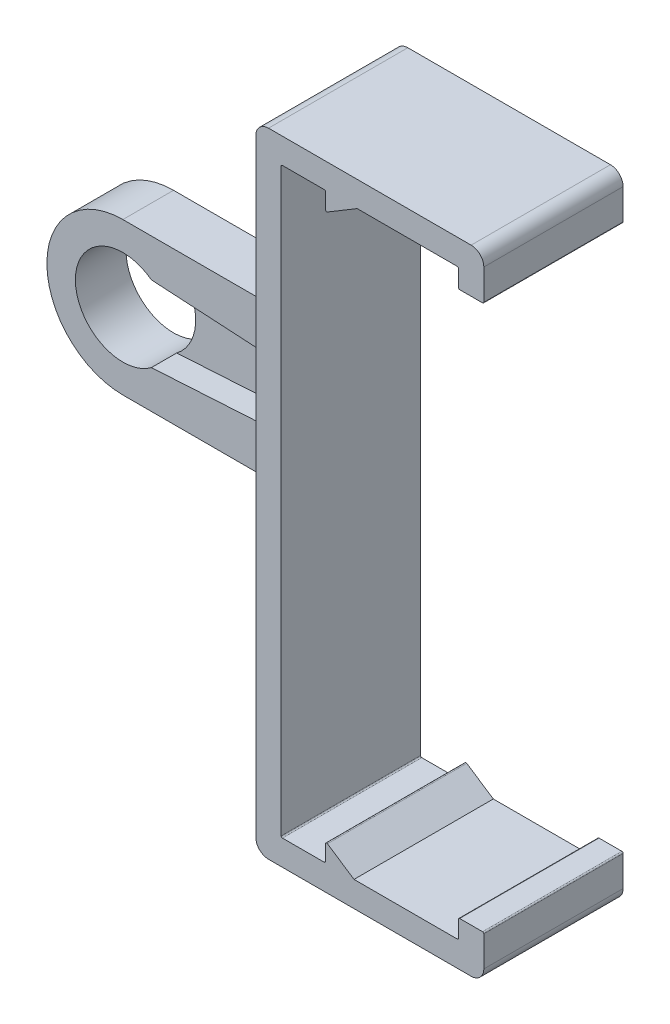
SolidWorks part; units mm, degrees
ref_plane "Front Plane" through (0, 0, 0) normal (0, 0, 1) x (1, 0, 0)
ref_plane "Top Plane" through (0, 0, 0) normal (0, 1, 0) x (1, 0, 0)
ref_plane "Right Plane" through (0, 0, 0) normal (1, 0, 0) x (0, 0, -1)
sketch "草图1" plane through (0, 0, 0) normal (0, 0, 1) x (1, 0, 0)
  line L9 (16.5828, -12.9023) -> (36.5828, -12.9023) construction
  line L10 (36.5828, -6.9023) -> (36.5828, -18.9023)
  line L11 (36.5828, -6.9023) -> (16.5828, -6.9023)
  line L12 (36.5828, -18.9023) -> (16.5828, -18.9023)
  circle A6 centre (16.5828, -12.9023) radius 3.75
  arc A7 (16.5828, -6.9023) -> (16.5828, -18.9023) centre (16.5828, -12.9023) ccw
  point P7 (36.5828, -12.9023)
  dimension "D1" = 7.5
  dimension "D2" = 12
  dimension "D3" = 20
  dimension "D4" = 12
extrude "凸台-拉伸1" add sketch "草图1" along normal blind 4
sketch "草图2" plane through (0, 0, 4) normal (0, 0, 1) x (1, 0, 0)
  line L0 (16.5828, -12.9023) -> (31.5828, -12.9023) construction
  line L1 (31.5828, -15.1523) -> (18.8328, -15.9023)
  line L2 (31.5828, -10.6523) -> (18.8328, -9.9023)
  arc A0 (31.5828, -15.1523) -> (31.5828, -10.6523) centre (31.5828, -12.9023) ccw
  circle A1 centre (16.5828, -12.9023) radius 3.75 construction
  arc A2 (18.8328, -9.9023) -> (18.8328, -15.9023) centre (16.5828, -12.9023) ccw
  dimension "D2" = 4.5
  dimension "D1" = 15
  dimension "D3" = 3
extrude "切除-拉伸1" cut sketch "草图2" against normal blind 2
sketch "草图3" plane through (36.5828, 0, 0) normal (1, 0, 0) x (0, 0, -1)
  line L0 (0, -18.9023) -> (0, -6.9023) construction
  line L1 (-11, -37.9023) -> (0, -37.9023)
  line L2 (-11, -37.9023) -> (-11, 12.0977)
  line L3 (-11, 12.0977) -> (0, 12.0977)
  line L4 (0, -37.9023) -> (0, 12.0977)
  line L5 (-4, -18.9023) -> (-4, -6.9023) construction
  line L6 (-4, -12.9023) -> (-18, -12.9023) construction
  point P10 (-11, -12.9023)
  dimension "D1" = 11
  dimension "D2" = 50
extrude "凸台-拉伸2" add sketch "草图3" along normal blind 18 from offset 2.5
sketch "草图5" plane through (0, 0, 11) normal (0, 0, 1) x (1, 0, 0)
  line L5 (48.5828, 8.5977) -> (55.9045, 8.5977)
  line L7 (48.5828, -34.4023) -> (55.9045, -34.4023)
  line L8 (48.5828, -34.4023) -> (48.5828, 8.5977)
  line L9 (37.5828, 8.5977) -> (37.5828, -34.4023)
  line L10 (37.5828, -34.4023) -> (48.5828, -34.4023)
  line L11 (48.5828, 8.5977) -> (37.5828, 8.5977)
  line L13 (37.5828, 8.5977) -> (37.5828, -34.4023)
  line L14 (37.5828, -34.4023) -> (48.5828, -34.4023)
  line L15 (48.5828, 8.5977) -> (37.5828, 8.5977)
  line L16 (55.9045, 8.5977) -> (55.9045, -34.4023)
  dimension "D1" = 3.5
extrude "切除-拉伸2" cut sketch "草图5" against normal blind 27.5
sketch "草图6" plane through (0, 0, 11) normal (0, 0, 1) x (1, 0, 0)
  line L0 (34.0828, 12.0977) -> (34.0828, -37.9023) construction
  line L1 (36.0828, 10.0977) -> (39.5828, 10.0977)
  line L2 (36.0828, 10.0977) -> (36.0828, -35.9023)
  line L3 (36.0828, -35.9023) -> (39.5828, -35.9023)
  line L4 (39.5828, 10.0977) -> (39.5828, 8.5977)
  line L5 (52.0828, 12.0977) -> (34.0828, 12.0977) construction
  line L6 (52.0828, -37.9023) -> (34.0828, -37.9023) construction
  line L7 (52.0828, 12.0977) -> (52.0828, 8.5977) construction
  line L8 (42.0828, 10.0977) -> (50.0828, 10.0977)
  line L10 (41.8328, -35.9023) -> (50.0828, -35.9023)
  line L11 (50.0828, 10.0977) -> (50.0828, -35.9023)
  line L12 (42.0828, 10.0977) -> (39.5828, 8.5977)
  line L13 (52.0828, 8.5977) -> (37.5828, 8.5977) construction
  line L14 (41.8328, -35.9023) -> (39.5828, -34.4073)
  line L15 (39.5828, -34.4073) -> (39.5828, -35.9023)
  point P8 (37.8328, -35.9023)
  dimension "D1" = 2
  dimension "D2" = 3.5
  dimension "D3" = 2
  dimension "D4" = 2
  dimension "D5" = 2
  dimension "D6" = 8
extrude "切除-拉伸3" cut sketch "草图6" against normal blind 27.5
fillet "圆角1" radius 0.1 12 edges at (39.5828, -34.4073, 5.5) (39.5828, 8.5977, 5.5) (36.0828, 10.0977, 5.5) (36.0828, -35.9023, 5.5) (52.0828, -34.4023, 5.5) (52.0828, 8.5977, 5.5) (50.0828, 8.5977, 5.5) (50.0828, -34.4023, 5.5) (50.0828, -35.9023, 5.5) (39.5828, -35.9023, 5.5) (50.0828, 10.0977, 5.5) (39.5828, 10.0977, 5.5)
fillet "圆角2" radius 1 6 edges at (34.0828, -6.9023, 2) (34.0828, -18.9023, 2) (34.0828, 12.0977, 5.5) (52.0828, 12.0977, 5.5) (52.0828, -37.9023, 5.5) (34.0828, -37.9023, 5.5)
